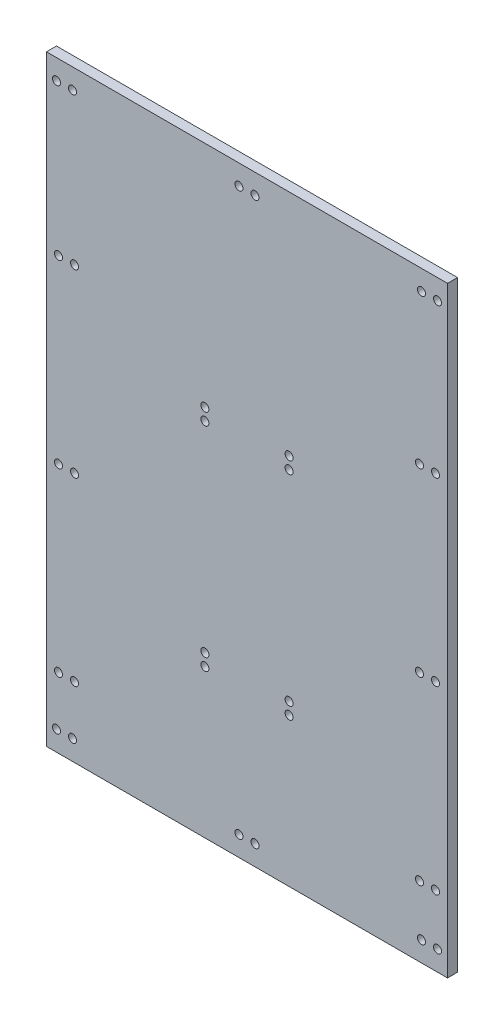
SolidWorks part; units mm, degrees
ref_plane "Front Plane" through (0, 0, 0) normal (0, 0, 1) x (1, 0, 0)
ref_plane "Top Plane" through (0, 0, 0) normal (0, 1, 0) x (1, 0, 0)
ref_plane "Right Plane" through (0, 0, 0) normal (1, 0, 0) x (0, 0, -1)
sketch "Sketch1" plane through (0, 0, 0) normal (0, 0, 1) x (1, 0, 0)
  line L1 (-100, -150) -> (100, -150)
  line L2 (-100, -150) -> (-100, 150)
  line L3 (-100, 150) -> (100, 150)
  line L4 (100, -150) -> (100, 150)
  line L5 (-100, -150) -> (100, 150) construction
  line L6 (-100, 150) -> (100, -150) construction
  point P0 (0, 0)
  dimension "D1" = 200
  dimension "D2" = 300
extrude "Boss-Extrude1" add sketch "Sketch1" along normal blind 5
sketch "Sketch2" plane through (0, 0, 5) normal (0, 0, 1) x (1, 0, 0)
  line L0 (-100, -25) -> (100, -25) construction
  line L1 (-100, 150) -> (-100, -150) construction
  line L2 (100, -150) -> (100, 150) construction
  line L3 (0, -0.7254) -> (0, -19.3655) construction
  line L4 (-100, 20) -> (100, 20) construction
  line L5 (0, 40.7254) -> (0, 59.3655) construction
  line L6 (-100, 65) -> (100, 65) construction
  line L7 (-100, -115) -> (100, -115) construction
  line L8 (0, -90.7254) -> (0, -109.3655) construction
  line L9 (-100, -150) -> (100, -150) construction
  circle A2 centre (-86, -25) radius 2
  circle A3 centre (-94, -25) radius 2
  circle A4 centre (86, -25) radius 2
  circle A5 centre (94, -25) radius 2
  circle A6 centre (94, 65) radius 2
  circle A7 centre (86, 65) radius 2
  circle A8 centre (-94, 65) radius 2
  circle A9 centre (-86, 65) radius 2
  circle A14 centre (-86, -115) radius 2
  circle A15 centre (-94, -115) radius 2
  circle A16 centre (86, -115) radius 2
  circle A17 centre (94, -115) radius 2
  point P55 (0, 0)
  dimension "D1" = 172
  dimension "D2" = 8
  dimension "D3" = 4
  dimension "D5" = 90
  dimension "D6" = 35
  dimension "D4" = 2
extrude "Cut-Extrude1" cut sketch "Sketch2" against normal blind 5
sketch "Sketch3" plane through (0, 0, 5) normal (0, 0, 1) x (1, 0, 0)
  line L0 (0, 24.2296) -> (0, -77.2221) construction
  line L1 (-31.5028, -20) -> (30.7981, -20) construction
  line L2 (-100, -150) -> (100, -150) construction
  circle A0 centre (-21, 30) radius 2
  circle A1 centre (-21, 36) radius 2
  circle A2 centre (21, 36) radius 2
  circle A3 centre (21, 30) radius 2
  circle A4 centre (21, -70) radius 2
  circle A5 centre (21, -76) radius 2
  circle A6 centre (-21, -76) radius 2
  circle A7 centre (-21, -70) radius 2
  dimension "D1" = 4
  dimension "D2" = 6
  dimension "D3" = 42
  dimension "D4" = 100
  dimension "D5" = 130
extrude "Cut-Extrude2" cut sketch "Sketch3" against normal blind 5
sketch "Sketch4" plane through (0, 0, 5) normal (0, 0, 1) x (1, 0, 0)
  line L0 (-100, 0) -> (100, 0) construction
  line L1 (-100, 150) -> (-100, -150) construction
  line L2 (100, -150) -> (100, 150) construction
  line L3 (-100, 140) -> (100, 140) construction
  line L4 (0, 150) -> (0, -150) construction
  line L5 (-100, -150) -> (100, -150) construction
  line L6 (100, 150) -> (-100, 150) construction
  line L7 (-100, -140) -> (100, -140) construction
  circle A1 centre (-95, 140) radius 2
  circle A2 centre (-87, 140) radius 2
  circle A3 centre (-4, 140) radius 2
  circle A4 centre (4, 140) radius 2
  circle A5 centre (95, 140) radius 2
  circle A6 centre (87, 140) radius 2
  circle A7 centre (87, -140) radius 2
  circle A8 centre (95, -140) radius 2
  circle A9 centre (4, -140) radius 2
  circle A10 centre (-4, -140) radius 2
  circle A11 centre (-87, -140) radius 2
  circle A12 centre (-95, -140) radius 2
  dimension "D1" = 4
  dimension "D2" = 8
  dimension "D3" = 5
  dimension "D4" = 8
  dimension "D5" = 4
  dimension "D6" = 10
extrude "Cut-Extrude3" cut sketch "Sketch4" against normal blind 214
